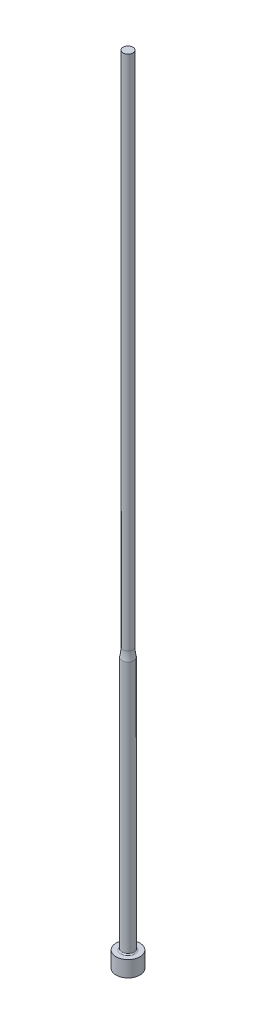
SolidWorks part; units mm, degrees
ref_plane "Front Plane" through (0, 0, 0) normal (0, 0, 1) x (1, 0, 0)
ref_plane "Top Plane" through (0, 0, 0) normal (0, 1, 0) x (1, 0, 0)
ref_plane "Right Plane" through (0, 0, 0) normal (1, 0, 0) x (0, 0, -1)
sketch "Sketch1" plane through (0, 0, 0) normal (0, 0, 1) x (1, 0, 0)
  line L0 (0, 0) -> (3, 0)
  line L1 (55, 0) -> (-55, 0) construction
  line L2 (3, 0) -> (3, 4)
  line L3 (3, 4) -> (1.8, 4)
  line L4 (1.5, 4.3) -> (1.5, 67.778)
  line L6 (1.25, 70) -> (1.25, 200)
  line L7 (1.25, 200) -> (0, 200)
  line L8 (0, 200) -> (0, 0)
  arc A0 (1.25, 70) -> (1.5, 67.778) centre (11.25, 70) ccw
  arc A1 (1.8, 4) -> (1.5, 4.3) centre (1.8, 4.3) cw
  dimension "D7" = 70
  dimension "D8" = 0.3
  dimension "D5" = 10
  dimension "D1" = 1.25
  dimension "D2" = 1.5
  dimension "D3" = 3
  dimension "D4" = 4
  dimension "D6" = 200
revolve "Revolve1" add sketch "Sketch1" angle 360 about L8
